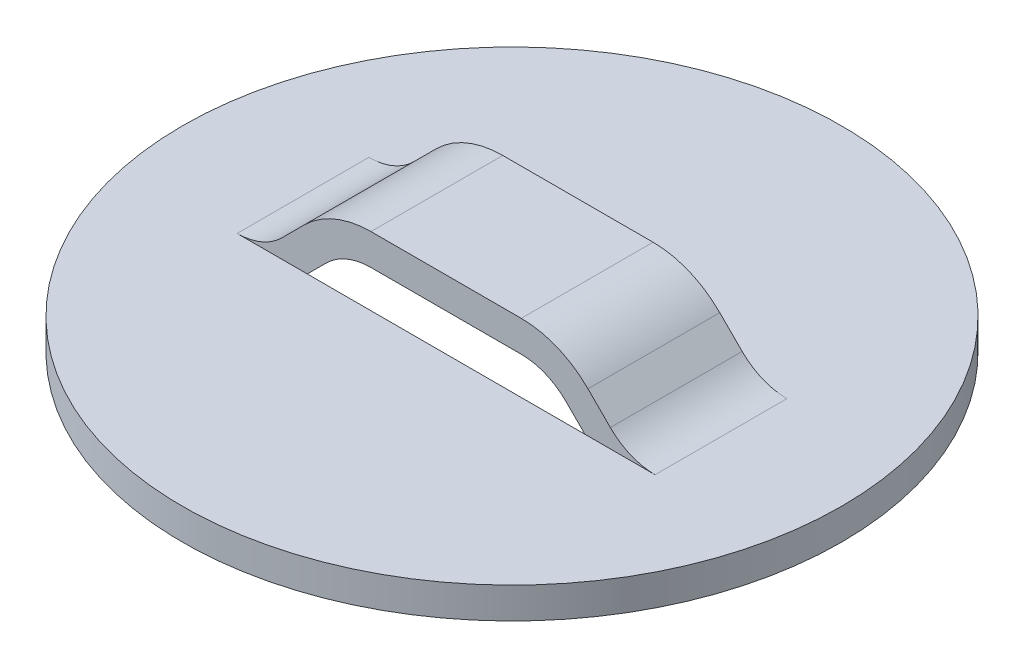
SolidWorks part; units mm, degrees
ref_plane "Front Plane" through (0, 0, 0) normal (0, 0, 1) x (1, 0, 0)
ref_plane "Top Plane" through (0, 0, 0) normal (0, 1, 0) x (1, 0, 0)
ref_plane "Right Plane" through (0, 0, 0) normal (1, 0, 0) x (0, 0, -1)
sketch "Sketch1" plane through (0, 0, 0) normal (0, 0, 1) x (1, 0, 0)
  line L0 (0, 0) -> (5.8077, 0)
  line L1 (15.875, 0) -> (15.875, 8.4226) construction
  line L2 (7.963, 0.8927) -> (9.0406, 1.9703)
  line L3 (12.2555, 3.302) -> (19.4945, 3.302)
  line L4 (22.7094, 1.9703) -> (23.787, 0.8927)
  line L5 (25.9423, 0) -> (31.75, 0)
  line L6 (0, -1.4986) -> (5.8077, -1.4986)
  line L7 (9.0226, -0.1669) -> (10.1002, 0.9107)
  line L8 (12.2555, 1.8034) -> (19.4945, 1.8034)
  line L9 (21.6498, 0.9107) -> (22.7274, -0.1669)
  line L10 (25.9423, -1.4986) -> (31.75, -1.4986)
  line L11 (0, 0) -> (0, -1.4986)
  line L12 (31.75, 0) -> (31.75, -1.4986)
  arc A0 (23.787, 0.8927) -> (25.9423, 0) centre (25.9423, 3.048) ccw
  arc A1 (7.963, 0.8927) -> (5.8077, 0) centre (5.8077, 3.048) cw
  arc A2 (19.4945, 3.302) -> (22.7094, 1.9703) centre (19.4945, -1.2446) cw
  arc A3 (9.0406, 1.9703) -> (12.2555, 3.302) centre (12.2555, -1.2446) cw
  arc A4 (9.0226, -0.1669) -> (5.8077, -1.4986) centre (5.8077, 3.048) cw
  arc A5 (10.1002, 0.9107) -> (12.2555, 1.8034) centre (12.2555, -1.2446) cw
  arc A6 (19.4945, 1.8034) -> (21.6498, 0.9107) centre (19.4945, -1.2446) cw
  arc A7 (22.7274, -0.1669) -> (25.9423, -1.4986) centre (25.9423, 3.048) ccw
  point P12 (24.6798, 0)
  point P15 (7.0702, 0)
  dimension "D4" = 3.048
  dimension "D5" = 4.5466
  dimension "D1" = 31.75
  dimension "D2" = 3.302
  dimension "D3" = 45
  dimension "D6" = 7.239
  dimension "D7" = 1.4986
extrude "Boss-Extrude1" add sketch "Sketch1" along normal blind 6.35
sketch "Sketch2" plane through (0, -1.4986, 0) normal (0, -1, 0) x (1, 0, 0)
  line L0 (15.875, 6.35) -> (15.875, 0) construction
  line L1 (12.2555, 6.35) -> (19.4945, 6.35) construction
  line L2 (12.2555, 0) -> (19.4945, 0) construction
  line L4 (5.8077, 0) -> (25.9423, 0)
  line L5 (5.8077, 0) -> (5.8077, 6.35)
  line L6 (5.8077, 6.35) -> (25.9423, 6.35)
  line L7 (25.9423, 0) -> (25.9423, 6.35)
  line L8 (5.8077, 0) -> (25.9423, 6.35) construction
  line L9 (5.8077, 6.35) -> (25.9423, 0) construction
  circle A0 centre (15.875, 3.175) radius 15.875
  point P6 (15.875, 3.175)
extrude "Boss-Extrude2" add sketch "Sketch2" against normal up to vertex
other "DeleteFace1"
